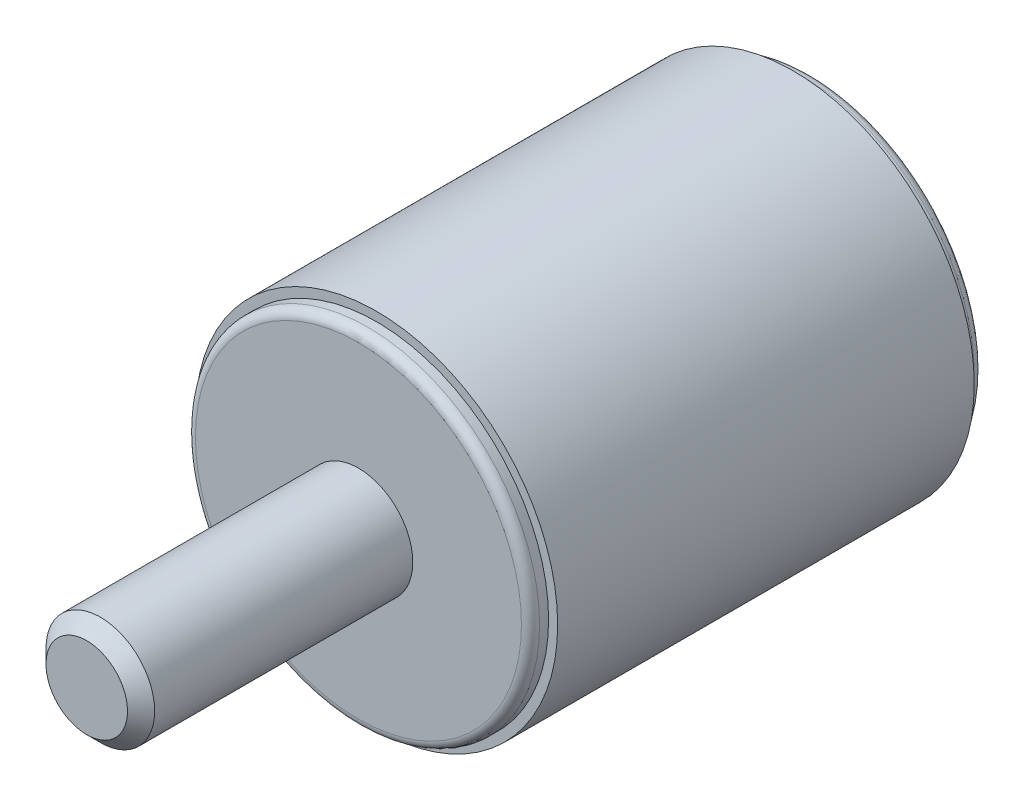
SolidWorks part; units mm, degrees
ref_plane "Plan de face" through (0, 0, 0) normal (0, 0, 1) x (1, 0, 0)
ref_plane "Plan de dessus" through (0, 0, 0) normal (0, 1, 0) x (1, 0, 0)
ref_plane "Plan de droite" through (0, 0, 0) normal (1, 0, 0) x (0, 0, -1)
sketch "Esquisse1" plane through (0, 0, 0) normal (0, 0, 1) x (1, 0, 0)
  circle A0 centre (0, 0) radius 10
  dimension "D1" = 20
extrude "Extrusion1" add sketch "Esquisse1" along normal blind 23
sketch "Esquisse2" plane through (0, 0, 23) normal (0, 0, 1) x (1, 0, 0)
  circle A0 centre (0, 0) radius 9.5
  dimension "D1" = 19
extrude "Extrusion2" add sketch "Esquisse2" along normal blind 1
sketch "Esquisse3" plane through (0, 0, 0) normal (0, 0, -1) x (-1, 0, 0)
  circle A0 centre (0, 0) radius 9.5
  dimension "D1" = 19
extrude "Extrusion3" add sketch "Esquisse3" along normal blind 1
fillet "Congé1" radius 0.5 2 edges at (-9.5, 0, -1) (9.5, 0, 24)
sketch "Esquisse4" plane through (0, 0, 24) normal (0, 0, 1) x (1, 0, 0)
  circle A0 centre (0, 0) radius 3
  dimension "D1" = 6
extrude "Extrusion4" add sketch "Esquisse4" along normal blind 15
chamfer "Chanfrein1" distance 0.75 angle 45 1 edges at (3, 0, 39)
sketch "Esquisse5" plane through (0, 0, -1) normal (0, 0, -1) x (-1, 0, 0)
  circle A0 centre (0, 0) radius 3
  dimension "D1" = 6
extrude "Enlèv. mat.-Extru.1" cut sketch "Esquisse5" against normal blind 5
sketch "Esquisse9" plane through (0, 0, 0) normal (0, 1, 0) x (1, 0, 0)
  line L0 (0, 2.3249) -> (0, -7.4236) construction
  line L1 (-3, -4) -> (0, -5.7321)
  line L2 (3, -4) -> (-3, -4) construction
  line L3 (-3, -4) -> (0, -4)
  line L4 (0, -5.7321) -> (0, -4)
  dimension "D1" = 30
revolve "Enlèvement de matière-Révolution1" cut sketch "Esquisse9" angle 360 about L0
